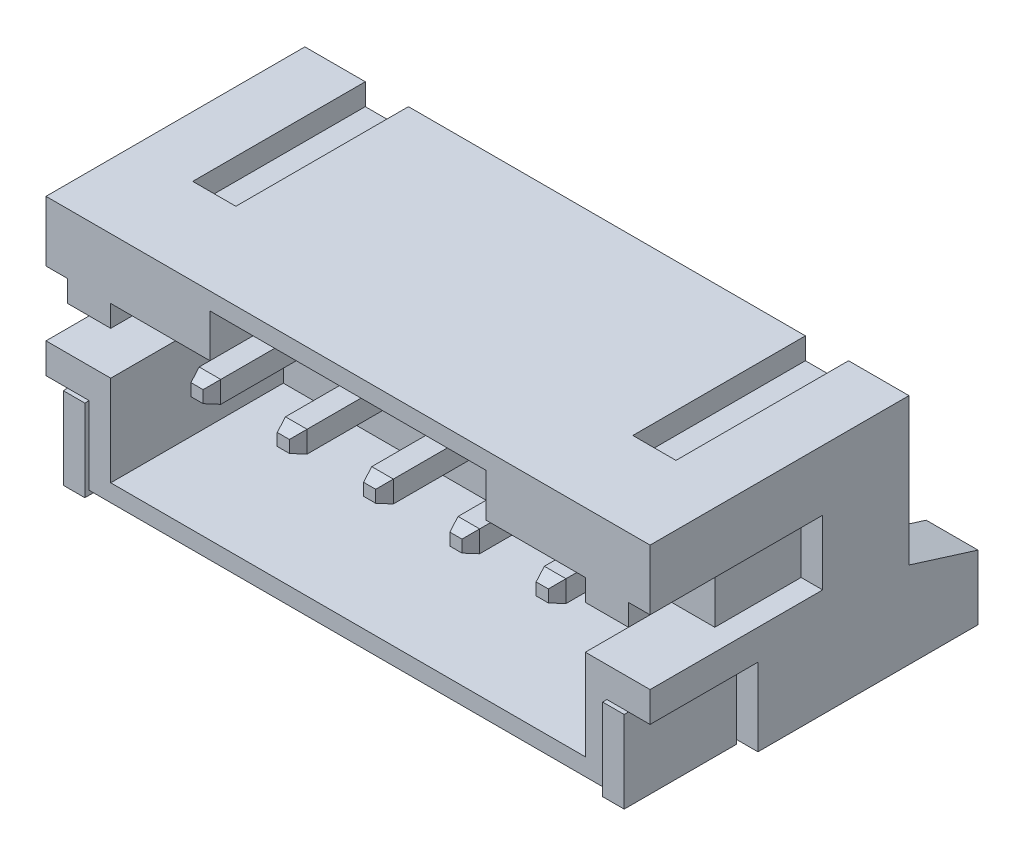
SolidWorks part; units mm, degrees
ref_plane "Front" through (0, 0, 0) normal (0, 0, 1) x (1, 0, 0)
ref_plane "Top" through (0, 0, 0) normal (0, 1, 0) x (1, 0, 0)
ref_plane "Right" through (0, 0, 0) normal (1, 0, 0) x (0, 0, -1)
sketch "Эскиз1" plane through (0, 0, 0) normal (1, 0, 0) x (0, 0, -1)
  line L0 (7.6, 1.6) -> (6, 2.1)
  line L1 (0, 0.1) -> (7.6, 0.1)
  line L2 (0, 0.1) -> (0, 2.6)
  line L3 (0, 5.5) -> (6, 5.5)
  line L4 (7.6, 0.1) -> (7.6, 1.6)
  line L5 (6, 2.1) -> (6, 5.5)
  line L6 (0, 3.6) -> (0, 5.5)
  line L7 (0, 3.6) -> (2, 3.6)
  line L9 (0, 2.6) -> (2, 2.6)
  line L10 (2, 3.6) -> (2, 2.6)
  dimension "D1" = 1.6
  dimension "D2" = 5.5
  dimension "D3" = 6
  dimension "D4" = 1.5
  dimension "D5" = 0.5
  dimension "D6" = 2.5
  dimension "D7" = 1
  dimension "D8" = 2
  dimension "D9" = 0.1
extrude "Вытянуть1" add sketch "Эскиз1" along normal mid plane 14
sketch "Эскиз2" plane through (0, 0, 0) normal (0, 0, 1) x (1, 0, 0)
  line L0 (0, 0.1) -> (0, 0.5) construction
  line L1 (-5.5, 0.5) -> (5.5, 0.5)
  line L2 (-5.5, 0.5) -> (-5.5, 4.1)
  line L3 (-5.5, 4.1) -> (-3.2, 4.1)
  line L4 (5.5, 0.5) -> (5.5, 4.1)
  line L5 (7, 0.1) -> (-7, 0.1) construction
  line L6 (-7, 2.6) -> (-7, 0.1) construction
  line L7 (3.2, 4.1) -> (5.5, 4.1)
  line L9 (-3.2, 4.1) -> (-3.2, 5.1)
  line L10 (-3.2, 5.1) -> (3.2, 5.1)
  line L11 (3.2, 4.1) -> (3.2, 5.1)
  line L13 (-7, 5.5) -> (-7, 3.6) construction
  line L14 (-7, 4.1) -> (-6.5, 4.1)
  line L15 (-7, 4.1) -> (-7, 2.6)
  line L16 (-7, 2.6) -> (-6.5, 2.6)
  line L17 (-6.5, 4.1) -> (-6.5, 2.6)
  line L18 (6.5, 4.1) -> (6.5, 2.6)
  line L19 (7, 2.6) -> (6.5, 2.6)
  line L20 (7, 4.1) -> (7, 2.6)
  line L21 (7, 4.1) -> (6.5, 4.1)
  line L24 (7, 2.6) -> (-7, 2.6) construction
  dimension "D1" = 1.5
  dimension "D2" = 11
  dimension "D3" = 3.6
  dimension "D4" = 4.6
  dimension "D5" = 0.4
  dimension "D6" = 6.4
  dimension "D7" = 3.8
  dimension "D8" = 0.5
extrude "Вытянуть2" cut sketch "Эскиз2" against normal blind 4
sketch "Эскиз3" plane through (0, 5.5, 0) normal (0, 1, 0) x (1, 0, 0)
  line L0 (7, 6) -> (-7, 6) construction
  line L1 (-5.8, 6) -> (5.8, 6)
  line L2 (-5.8, 6) -> (-5.8, 7.6)
  line L3 (-5.8, 7.6) -> (5.8, 7.6)
  line L4 (5.8, 6) -> (5.8, 7.6)
  line L5 (7, 7.6) -> (-7, 7.6) construction
  line L6 (0, 6) -> (0, 0) construction
  line L7 (-7, 7.6) -> (-7, 6) construction
  dimension "D1" = 1.2
extrude "Вытянуть3" cut sketch "Эскиз3" against normal through all
ref_plane "Плоскость1" through (-4, 0, 0) normal (-1, 0, 0) x (0, 0, 1)
sketch "Эскиз5" plane through (0, 0, 0) normal (0, 0, 1) x (1, 0, 0)
  line L0 (-7, 2.6) -> (-7, 0.1) construction
  line L1 (-7, 1.9) -> (-6.1, 1.9)
  line L2 (-7, 1.9) -> (-7, 0.1)
  line L3 (-7, 0.1) -> (-6.1, 0.1)
  line L4 (-6.1, 1.9) -> (-6.1, 0.1)
  line L5 (7, 0.1) -> (-7, 0.1) construction
  line L6 (0, 0) -> (0, 5.5) construction
  line L7 (7, 5.5) -> (-7, 5.5) construction
  line L8 (6.1, 1.9) -> (6.1, 0.1)
  line L9 (7, 0.1) -> (6.1, 0.1)
  line L10 (7, 1.9) -> (7, 0.1)
  line L11 (7, 1.9) -> (6.1, 1.9)
  dimension "D1" = 0.9
  dimension "D2" = 1.8
extrude "Вытянуть5" cut sketch "Эскиз5" against normal blind 2.5
sketch "Эскиз6" plane through (0, 0, 0) normal (0, 0, 1) x (1, 0, 0)
  line L0 (-6.1, 1.9) -> (-7, 1.9) construction
  line L1 (-6.5, 1.9) -> (-6, 1.9)
  line L2 (-6.5, 1.9) -> (-6.5, 0)
  line L3 (-6.5, 0) -> (-6, 0)
  line L4 (-6, 1.9) -> (-6, 0)
  line L6 (-6.25, 0) -> (-6.25, 1.9) construction
  line L7 (-7, 1.9) -> (-7, 0.1) construction
  line L8 (0, 0) -> (0, 5.5) construction
  line L9 (7, 5.5) -> (-7, 5.5) construction
  line L10 (6, 1.9) -> (6, 0)
  line L11 (6.5, 0) -> (6, 0)
  line L12 (6.5, 1.9) -> (6.5, 0)
  line L13 (6.5, 1.9) -> (6, 1.9)
  dimension "D1" = 0.75
  dimension "D2" = 0.5
sketch "Эскиз4" plane through (-4, 0, 0) normal (-1, 0, 0) x (0, 0, 1)
  line L0 (-0.5, 2.55) -> (-5.6, 2.55)
  line L1 (-6.1, 2.05) -> (-6.1, 1)
  line L3 (-7.1, 0) -> (-8.6, 0)
  line L4 (-0.5, 3.05) -> (-5.6, 3.05)
  line L5 (-6.6, 2.05) -> (-6.6, 1)
  line L6 (-7.1, 0.5) -> (-8.6, 0.5)
  line L7 (-0.5, 2.55) -> (-0.5, 3.05)
  line L8 (-8.6, 0) -> (-8.6, 0.5)
  line L9 (-4, 0.5) -> (0, 0.5) construction
  line L10 (0, 2.6) -> (0, 1.9) construction
  line L12 (-6, 0.1) -> (-6, 2.1) construction
  arc A0 (-6.1, 1) -> (-7.1, 0) centre (-7.1, 1) cw
  arc A1 (-5.6, 2.55) -> (-6.1, 2.05) centre (-5.6, 2.05) ccw
  arc A2 (-5.6, 3.05) -> (-6.6, 2.05) centre (-5.6, 2.05) ccw
  arc A3 (-6.6, 1) -> (-7.1, 0.5) centre (-7.1, 1) cw
  arc A4 (-6.1, 1) -> (-7.1, 0) centre (-7.1, 1) cw construction
  dimension "D1" = 1
  dimension "D2" = 0.5
  dimension "D4" = 2.05
  dimension "D5" = 0.5
  dimension "D6" = 8.6
  dimension "D7" = 0.1
  dimension "D3" = 0.5
extrude "Вытянуть4" add sketch "Эскиз4" along normal mid plane 0.5
chamfer "Фаска1" distance 0.3 angle 20 4 edges at (-4, 2.55, -0.5) (-4.25, 2.8, -0.5) (-4, 3.05, -0.5) (-3.75, 2.8, -0.5)
extrude "Вытянуть6" add sketch "Эскиз6" along normal blind 0.1 and the other way blind 2.5
pattern_linear "Линейный массив1" count 5 spacing 2 along (1, 0, 0) of "Вытянуть4", "Фаска1"
sketch "Эскиз7" plane through (0, 5.5, 0) normal (0, 1, 0) x (1, 0, 0)
  line L0 (7, 6) -> (-7, 6) construction
  line L1 (-5.6, 6) -> (-4.6, 6)
  line L2 (-5.6, 6) -> (-5.6, 2)
  line L3 (-5.6, 2) -> (-4.6, 2)
  line L4 (-4.6, 6) -> (-4.6, 2)
  line L5 (0, 0) -> (0, 6) construction
  line L6 (4.6, 6) -> (4.6, 2)
  line L7 (5.6, 2) -> (4.6, 2)
  line L8 (5.6, 6) -> (5.6, 2)
  line L9 (5.6, 6) -> (4.6, 6)
  line L10 (-7, 6) -> (-7, 0) construction
  dimension "D1" = 1
  dimension "D2" = 1.4
  dimension "D3" = 4
extrude "Вытянуть7" cut sketch "Эскиз7" against normal blind 0.5
equation "\"D1@Вытянуть1\" =  ((\"D1@Линейный массив1\" - 1) * 2 ) + 6"
